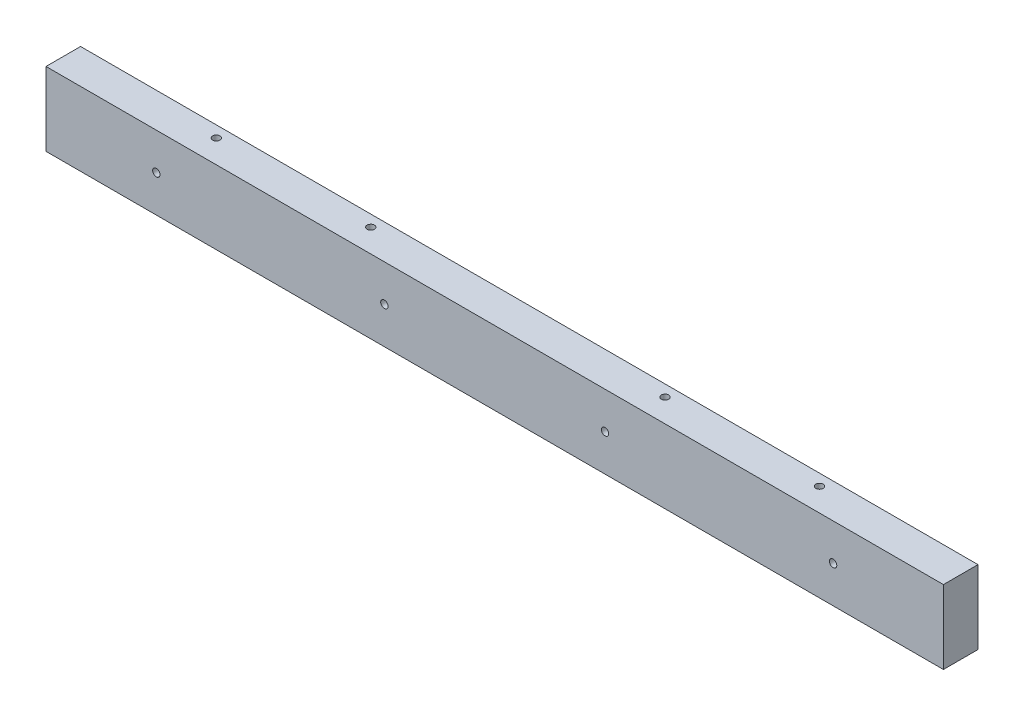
SolidWorks part; units mm, degrees
ref_plane "Front Plane" through (0, 0, 0) normal (0, 0, 1) x (1, 0, 0)
ref_plane "Top Plane" through (0, 0, 0) normal (0, 1, 0) x (1, 0, 0)
ref_plane "Right Plane" through (0, 0, 0) normal (1, 0, 0) x (0, 0, -1)
sketch "Sketch1" plane through (0, 0, 0) normal (0, 1, 0) x (1, 0, 0)
  line L1 (0, 0) -> (1220, 0)
  line L2 (0, 0) -> (0, 47)
  line L3 (0, 47) -> (1220, 47)
  line L4 (1220, 0) -> (1220, 47)
  dimension "D1" = 47
  dimension "D2" = 1220
extrude "Boss-Extrude1" add sketch "Sketch1" along normal blind 100
sketch "Sketch2" plane through (0, 0, 0) normal (0, 0, 1) x (1, 0, 0)
  line L0 (0, 50) -> (1220, 50) construction
  line L1 (0, 100) -> (0, 0) construction
  line L2 (1220, 100) -> (1220, 0) construction
  line L3 (610, 100) -> (610, 0) construction
  line L4 (0, 100) -> (1220, 100) construction
  line L5 (0, 0) -> (1220, 0) construction
  line L6 (150, 50) -> (460, 50) construction
  circle A0 centre (150, 50) radius 5
  circle A1 centre (460, 50) radius 5
  circle A2 centre (760, 50) radius 5
  circle A3 centre (1070, 50) radius 5
  dimension "D1" = 10
  dimension "D2" = 150
  dimension "D4" = 150
  dimension "D3" = 2
extrude "Cut-Extrude1" cut sketch "Sketch2" against normal up to next
sketch "Sketch3" plane through (0, 100, 0) normal (0, 1, 0) x (1, 0, 0)
  circle A0 centre (1020, 31.5) radius 5 construction
  circle A1 centre (810, 31.5) radius 5 construction
  circle A2 centre (410, 31.5) radius 5 construction
  circle A3 centre (200, 31.5) radius 5 construction
  circle A4 centre (1020, 31.5) radius 5
  circle A5 centre (810, 31.5) radius 5
  circle A6 centre (410, 31.5) radius 5
  circle A7 centre (200, 31.5) radius 5
extrude "Cut-Extrude2" cut sketch "Sketch3" against normal up to next
